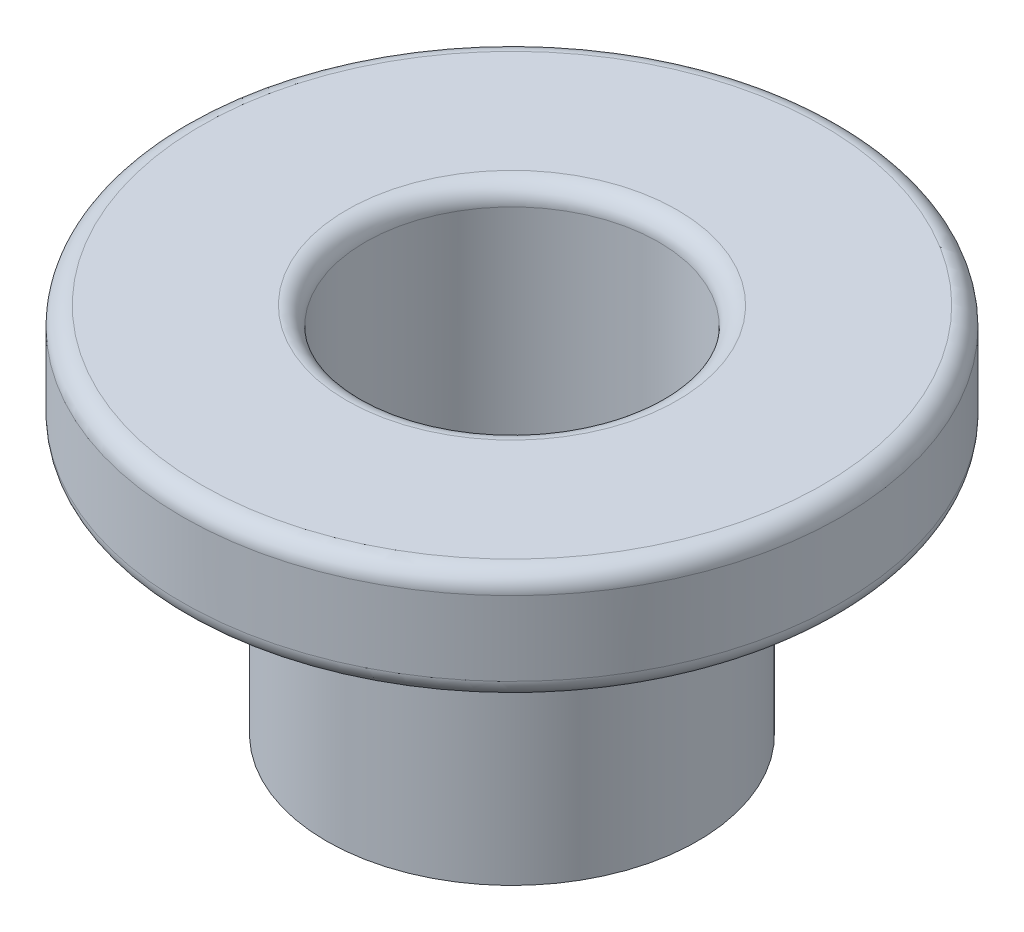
SolidWorks part; units mm, degrees
ref_plane "Front" through (0, 0, 0) normal (0, 0, 1) x (1, 0, 0)
ref_plane "Top" through (0, 0, 0) normal (0, 1, 0) x (1, 0, 0)
ref_plane "Right" through (0, 0, 0) normal (1, 0, 0) x (0, 0, -1)
sketch "Sketch1" plane through (0, 0, 0) normal (0, 0, 1) x (1, 0, 0)
  line L0 (2.0066, 0) -> (2.0066, 5.08)
  line L1 (2.0066, 5.08) -> (4.5085, 5.08)
  line L2 (4.5085, 5.08) -> (4.5085, 3.556)
  line L3 (4.5085, 3.556) -> (2.54, 3.556)
  line L4 (2.54, 3.556) -> (2.54, 0)
  line L5 (2.54, 0) -> (2.0066, 0)
  line L6 (0, 0) -> (0, 5.08) construction
  dimension "D1" = 2.54
  dimension "D2" = 2.0066
  dimension "D3" = 4.5085
  dimension "D4" = 1.524
  dimension "D5" = 5.08
revolve "Revolve1" add sketch "Sketch1" angle 360 about L6
fillet "Fillet1" radius 0.254 3 edges at (0, 3.556, -4.5085) (0, 5.08, -4.5085) (0, 5.08, -2.0066)
